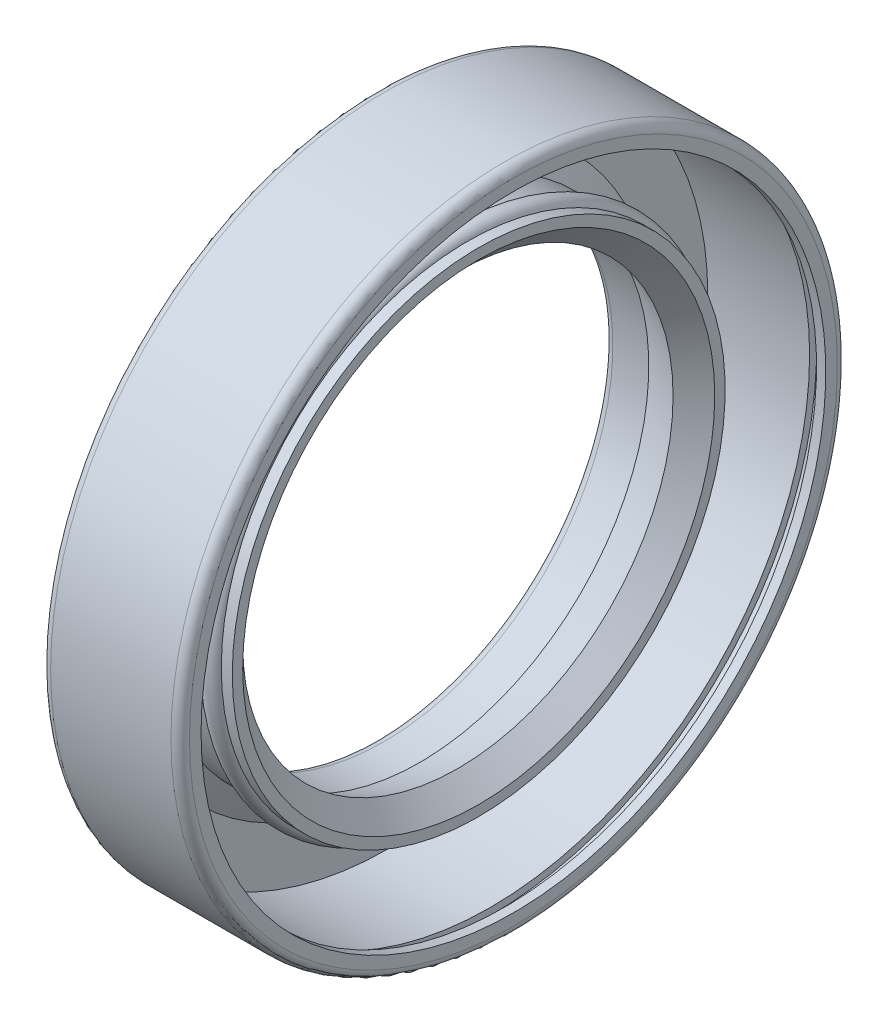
SolidWorks part; units mm, degrees
ref_plane "Plan1" through (0, 0, 0) normal (0, 0, 1) x (1, 0, 0)
ref_plane "Plan2" through (0, 0, 0) normal (0, 1, 0) x (1, 0, 0)
ref_plane "Plan3" through (0, 0, 0) normal (1, 0, 0) x (0, 0, -1)
sketch "Esquisse1" plane through (0, 0, 0) normal (0, 1, 0) x (1, 0, 0)
  line L0 (0, 0) -> (4.1667, 0) construction
  line L1 (0, 9.433) -> (0, 11.6667)
  line L2 (0.3333, 12) -> (4.6667, 12)
  line L3 (4.1667, 11.5) -> (4.1667, 11.75)
  line L4 (4.1667, 11.5) -> (0.5, 11.5)
  line L5 (0.5, 11.5) -> (0.5, 9.567)
  line L6 (0, 9.433) -> (0.25, 9)
  line L7 (0.25, 9) -> (0, 9)
  line L8 (0, 9) -> (0, 8.5833)
  line L9 (4.1667, 11.75) -> (4.6667, 11.75)
  line L10 (0.3333, 8.25) -> (1.6263, 8.25)
  line L11 (4.6667, 11.75) -> (4.6667, 11.25)
  line L12 (5, 11.25) -> (5, 11.6667)
  line L13 (4.6667, 11.25) -> (5, 11.25)
  line L14 (1.6263, 8.25) -> (3, 7.75)
  line L15 (3, 7.75) -> (3.75, 8.5)
  line L16 (3.75, 8.5) -> (3.75, 8.875)
  line L17 (3.75, 8.875) -> (3.3536, 8.875)
  line L18 (0.5, 9.567) -> (0.9717, 8.75)
  line L22 (0.9717, 8.75) -> (2.625, 8.75)
  arc A0 (0, 11.6667) -> (0.3333, 12) centre (0.3333, 11.6667) cw
  arc A1 (3.3536, 8.875) -> (2.625, 8.75) centre (3, 8.75) ccw
  arc A2 (4.6667, 12) -> (5, 11.6667) centre (4.6667, 11.6667) cw
  arc A3 (0, 8.5833) -> (0.3333, 8.25) centre (0.3333, 8.5833) ccw
  point P13 (0, 12)
  point P22 (5, 12)
  dimension "r" = 0.3333
  dimension "l" = 0.75
  dimension "De" = 12
  dimension "b" = 5
  dimension "e" = 0.5
  dimension "D7" = 45
  dimension "D6" = 20
  dimension "Di" = 7.75
  dimension "pl" = 3.75
  dimension "D16" = 60
  dimension "h" = 0.125
revolve "Base-Révolution" add sketch "Esquisse1" angle 360 about L0
equation "\"e@Esquisse1\" = \"b@Esquisse1\"/10"
equation "\"i@Esquisse1\"=\"e@Esquisse1\"/2"
equation "\"r@Esquisse1\"=\"e@Esquisse1\"*2/3"
equation "\"l@Esquisse1\"=\"i@Esquisse1\"*3"
equation "\"pl@Esquisse1\"=\"b@Esquisse1\"*3/4"
equation "\"h@Esquisse1\"=\"i@Esquisse1\"/2"
